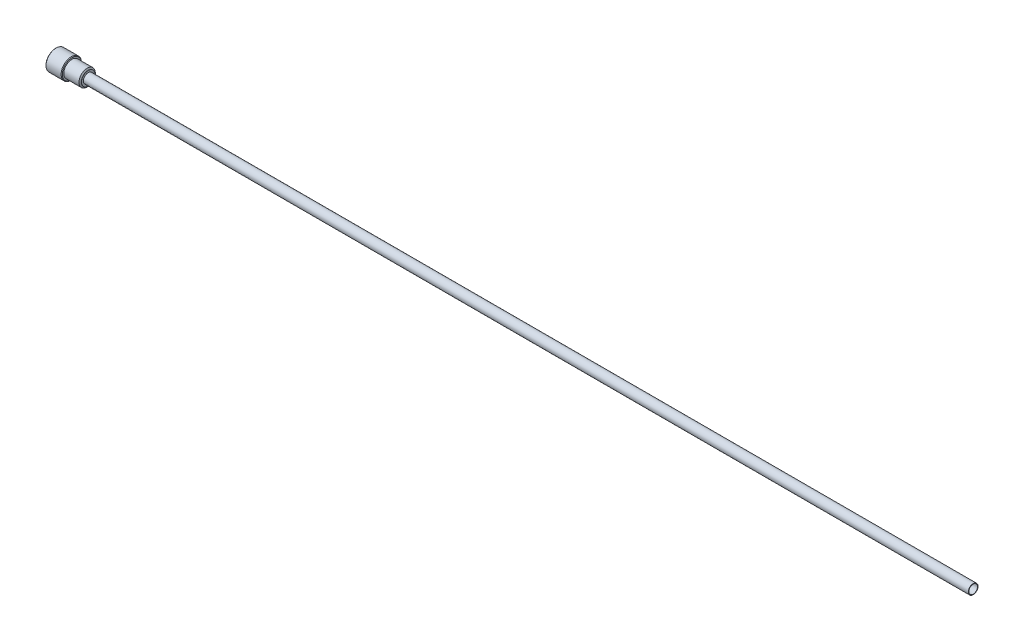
SolidWorks part; units mm, degrees
ref_plane "Front Plane" through (0, 0, 0) normal (0, 0, 1) x (1, 0, 0)
ref_plane "Top Plane" through (0, 0, 0) normal (0, 1, 0) x (1, 0, 0)
ref_plane "Right Plane" through (0, 0, 0) normal (1, 0, 0) x (0, 0, -1)
sketch "Sketch1" plane through (0, 0, 0) normal (0, 0, 1) x (1, 0, 0)
  line L1 (16, 2.3749) -> (450, 2.3749)
  line L2 (8, 4) -> (15.493, 4)
  line L3 (8, 4) -> (8, 5)
  line L4 (16, 3.295) -> (16, 2.3749)
  line L5 (450, 2.3749) -> (450, 2.1209)
  line L6 (8, 5) -> (0, 5)
  line L7 (450, 2.1209) -> (0, 2.1209)
  line L8 (0, 2.1209) -> (0, 5)
  line L9 (-22.2122, 0) -> (63.2184, 0) construction
  line L11 (15.9, 3.295) -> (15.493, 4)
  line L13 (16, 3.295) -> (15.9, 3.295)
  dimension "D2" = 8
  dimension "D1" = 10
  dimension "D3" = 16
  dimension "tube ID" = 4.2418
  dimension "D4" = 60
  dimension "D5" = 0.1
  dimension "D6" = 4.7498
  dimension "D7" = 450
  dimension "D8" = 8
  dimension "D9" = 6.59
revolve "Revolve1" add sketch "Sketch1" angle 360 about L9
chamfer "Chamfer3" distance 0.3 angle 45 2 edges at (8, 0, 5) (0, 0, 5)
sketch "Sketch6" plane through (0, 0, 0) normal (0, 0, 1) x (1, 0, 0)
  line L0 (0, 0) -> (-17.6495, 0) construction
  line L2 (450, 0) -> (0, 0) construction
  line L3 (0, 0) -> (0, 3)
  line L5 (0, 3) -> (4.5, 3)
  line L6 (4.5, 3) -> (6.3026, 0)
  line L7 (6.3026, 0) -> (0, 0)
  dimension "D1" = 6
  dimension "D2" = 59
  dimension "D3" = 4.5
revolve "Cut-Revolve1" cut sketch "Sketch6" angle 360 about L0
chamfer "Chamfer2" distance 0.6 angle 45 1 edges at (0, 0, -3)
sketch "Sketch7" plane through (0, 0, 0) normal (-1, 0, 0) x (0, 0, 1)
  line L2 (-1.7321, 3) -> (-3.4641, 0)
  line L3 (-3.4641, 0) -> (-1.7321, -3)
  line L4 (-1.7321, -3) -> (1.7321, -3)
  line L5 (1.7321, -3) -> (3.4641, 0)
  line L6 (3.4641, 0) -> (1.7321, 3)
  line L7 (1.7321, 3) -> (-1.7321, 3)
  circle A0 centre (0, 0) radius 3 construction
  circle A1 centre (0, 0) radius 3 construction
extrude "Cut-Extrude1" cut sketch "Sketch7" against normal up to surface (4.2211 mm away)
